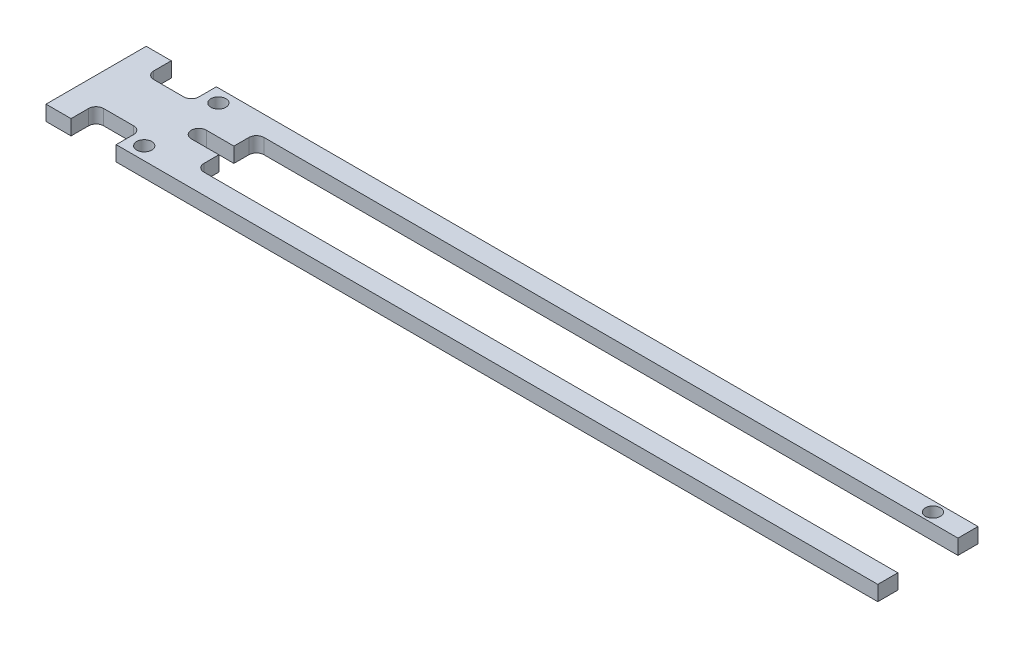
SolidWorks part; units mm, degrees
ref_plane "Спереди" through (0, 0, 0) normal (0, 0, 1) x (1, 0, 0)
ref_plane "Сверху" through (0, 0, 0) normal (0, 1, 0) x (1, 0, 0)
ref_plane "Справа" through (0, 0, 0) normal (1, 0, 0) x (0, 0, -1)
sketch "Эскиз1" plane through (0, 0, 0) normal (0, 1, 0) x (1, 0, 0)
  line L0 (55.4579, 3.1053) -> (-13.7921, 3.1053)
  line L1 (-27.5421, 5.1053) -> (-25.0421, 5.1053)
  line L2 (-27.5421, 5.1053) -> (-27.5421, -4.8947)
  line L3 (-27.5421, -4.8947) -> (-25.0421, -4.8947)
  line L4 (55.4579, 5.1053) -> (55.4579, 3.1053)
  line L5 (55.4579, -2.8947) -> (-13.7921, -2.8947)
  line L6 (-14.5421, 2.3553) -> (-14.5421, 0.8553)
  line L7 (-25.0421, 5.1053) -> (-25.0421, 3.3553)
  line L8 (-20.5421, 3.3553) -> (-20.5421, 5.1053)
  line L9 (-24.2921, 2.6053) -> (-21.2921, 2.6053)
  line L10 (-14.5421, -0.6447) -> (-14.5421, -2.1447)
  line L11 (-24.2921, -2.3947) -> (-21.2921, -2.3947)
  line L12 (-14.5421, 0.8553) -> (-17.2921, 0.8553)
  line L13 (-20.5421, -3.1447) -> (-20.5421, -4.8947)
  line L14 (-20.5421, 5.1053) -> (55.4579, 5.1053)
  line L15 (-20.5421, -4.8947) -> (55.4579, -4.8947)
  line L16 (-25.0421, -3.1447) -> (-25.0421, -4.8947)
  line L17 (55.4579, -2.8947) -> (55.4579, -4.8947)
  line L18 (-14.5421, -0.6447) -> (-17.2921, -0.6447)
  circle A0 centre (-19.0421, 3.8053) radius 0.75
  circle A1 centre (-19.0421, -3.5947) radius 0.75
  circle A2 centre (51.9579, 4.1053) radius 0.75
  arc A3 (-13.7921, -2.8947) -> (-14.5421, -2.1447) centre (-13.7921, -2.1447) cw
  arc A4 (-13.7921, 3.1053) -> (-14.5421, 2.3553) centre (-13.7921, 2.3553) ccw
  arc A5 (-21.2921, -2.3947) -> (-20.5421, -3.1447) centre (-21.2921, -3.1447) cw
  arc A6 (-25.0421, -3.1447) -> (-24.2921, -2.3947) centre (-24.2921, -3.1447) cw
  arc A7 (-21.2921, 2.6053) -> (-20.5421, 3.3553) centre (-21.2921, 3.3553) ccw
  arc A8 (-24.2921, 2.6053) -> (-25.0421, 3.3553) centre (-24.2921, 3.3553) cw
  arc A9 (-17.2921, 0.8553) -> (-17.2921, -0.6447) centre (-17.2921, 0.1053) ccw
  point P32 (-20.5421, -2.3947)
  point P37 (-20.5421, 2.6053)
  point P40 (-25.0421, 2.6053)
  dimension "D13" = 1.5
  dimension "D14" = 1.3
  dimension "D15" = 8.5
  dimension "D16" = 1.5
  dimension "D17" = 1.3
  dimension "D18" = 8.5
  dimension "D19" = 1.5
  dimension "D20" = 3.5
  dimension "D21" = 0.75
  dimension "D1" = 10
  dimension "D2" = 83
  dimension "D3" = 2
  dimension "D4" = 2
  dimension "D5" = 13
  dimension "D6" = 2.5
  dimension "D7" = 5
  dimension "D8" = 2.5
  dimension "D9" = 4.5
  dimension "D10" = 2.75
  dimension "D12" = 4.25
extrude "Бобышка-Вытянуть1" add sketch "Эскиз1" along normal blind 1.5 contours A9 L12 L6 A4 L0 L4 L14 L8 A7 L9 A8 L7 L1 L2 L3 L16 A6 L11 A5 L13 L15 L17 L5 A3 L10 L18 A2 A1 A0
